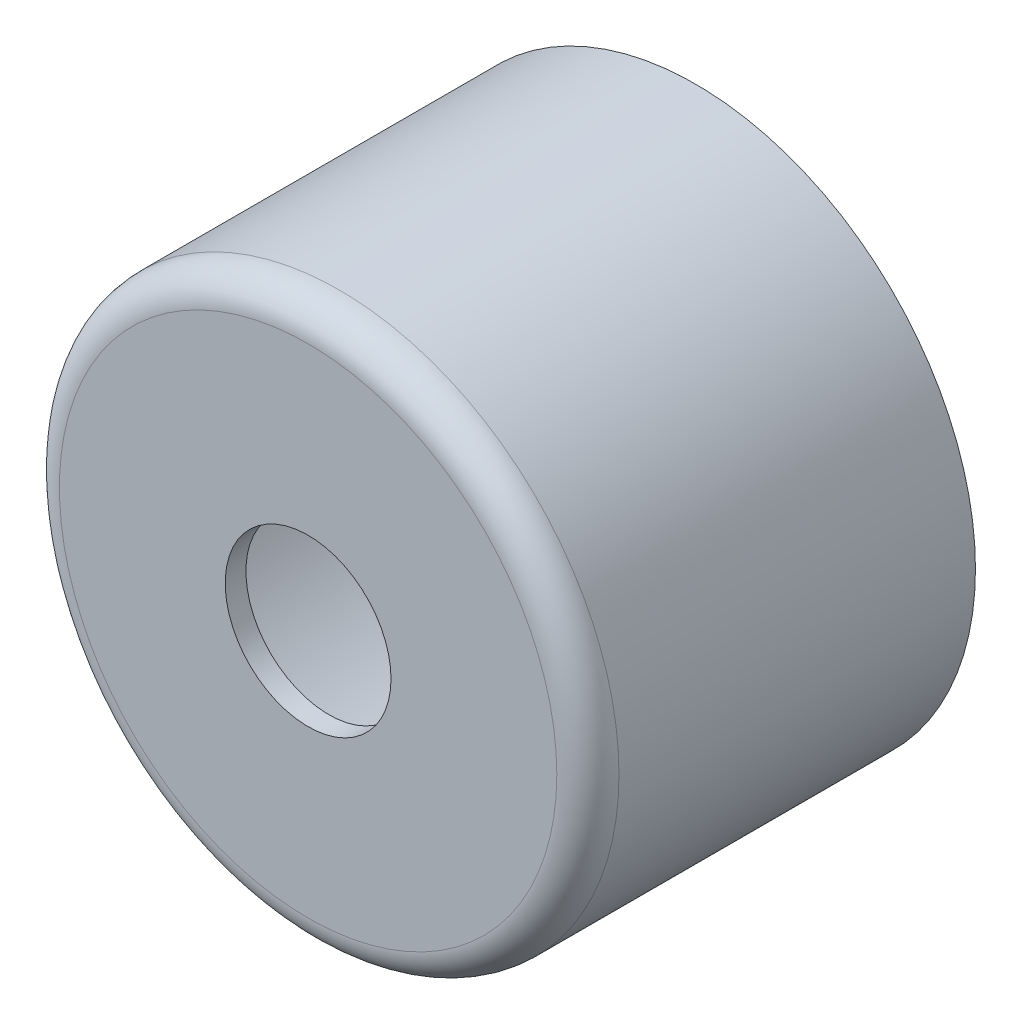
SolidWorks part; units mm, degrees
ref_plane "Plan de face" through (0, 0, 0) normal (0, 0, 1) x (1, 0, 0)
ref_plane "Plan de dessus" through (0, 0, 0) normal (0, 1, 0) x (1, 0, 0)
ref_plane "Plan de droite" through (0, 0, 0) normal (1, 0, 0) x (0, 0, -1)
sketch "Esquisse1" plane through (0, 0, 0) normal (0, 0, 1) x (1, 0, 0)
  circle A0 centre (0, 0) radius 13.5
extrude "Extrusion1" add sketch "Esquisse1" along normal blind 18.7
fillet "Congé1" radius 1.5 1 edges at (13.5, 0, 18.7)
shell "Coque1" thickness 1
sketch "Esquisse2" plane through (0, 0, 18.7) normal (0, 0, 1) x (1, 0, 0)
  circle A0 centre (0, 0) radius 4
extrude "Enlèv. mat.-Extru.1" cut sketch "Esquisse2" against normal through all
sketch "Esquisse3" plane through (0, 0, 17.7) normal (0, 0, -1) x (-1, 0, 0)
  text T0 "www.a4.fr" font "Arial" height 0.01
extrude "Enlèv. mat.-Extru.2" cut sketch "Esquisse3" against normal blind 0.01
